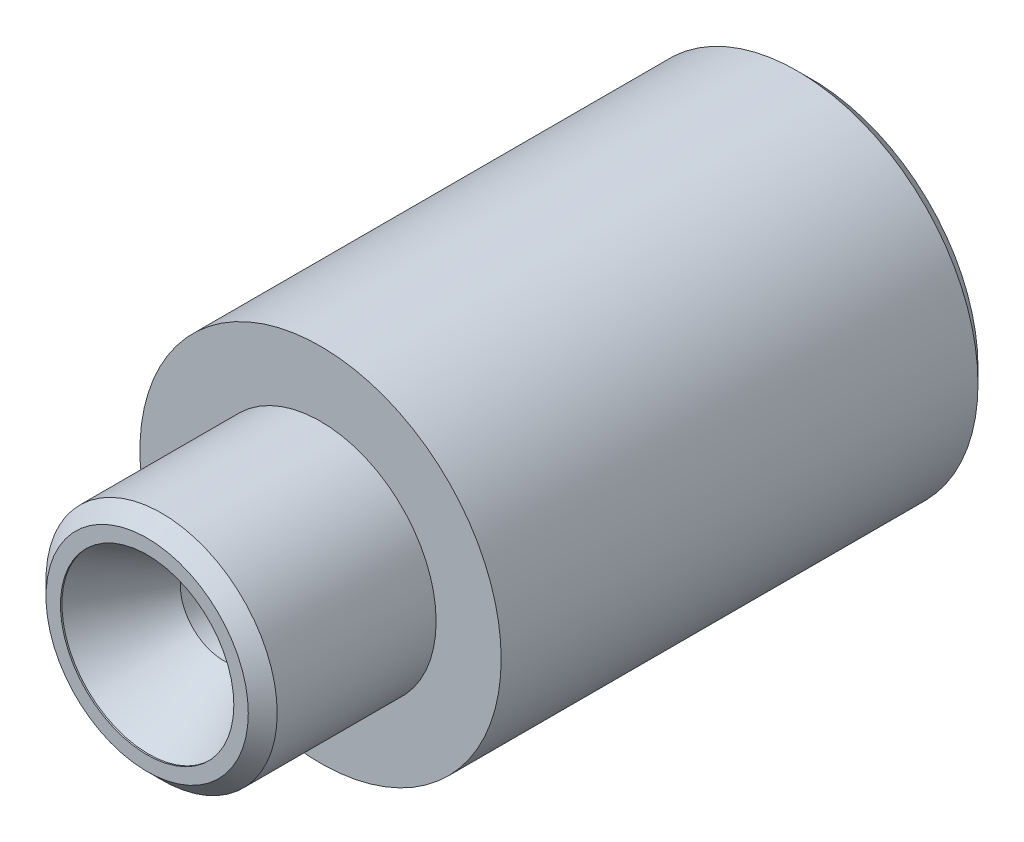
SolidWorks part; units mm, degrees
ref_plane "Plan1" through (0, 0, 0) normal (0, 0, 1) x (1, 0, 0)
ref_plane "Plan2" through (0, 0, 0) normal (0, 1, 0) x (1, 0, 0)
ref_plane "Plan3" through (0, 0, 0) normal (1, 0, 0) x (0, 0, -1)
sketch "Esquisse1" plane through (0, 0, 0) normal (0, 0, 1) x (1, 0, 0)
  circle A0 centre (0, 0) radius 6.25
  dimension "D1" = 12.5
extrude "cylindre" add sketch "Esquisse1" along normal blind 17
sketch "Esquisse2" plane through (0, 0, 17) normal (0, 0, 1) x (1, 0, 0)
  circle A0 centre (0, 0) radius 4
  circle A1 centre (0, 0) radius 6.25 construction
  dimension "D1" = 8
extrude "épaulement" add sketch "Esquisse2" along normal blind 6
chamfer "Chanfrein1" distance 0.5 angle 45
hole_wizard "Perçage" positions "Esquisse6" profile "Esquisse5" legacy
sketch "Esquisse6" plane through (0, 0, 0) normal (0, 0, -1) x (-1, 0, 0)
  point P0 (0, 0)
sketch "Esquisse5" plane through (0, 0, 0) normal (1, 0, 0) x (0, 1, 0)
  line L0 (0, 0) -> (0, 13.5515)
  line L1 (0, 13.5515) -> (1.75, 12.5)
  line L2 (1.75, 12.5) -> (1.75, 0)
  line L4 (1.75, 0) -> (0, 0)
  line L6 (0, 13.5515) -> (-1.75, 12.5) construction
  line L7 (0, -4.2442) -> (0, 117.3081) construction
  dimension "Diamètre" = 3.5
  dimension "Profondeur" = 12.5
  dimension "Angle" = 118
hole_wizard "contre-pointe" positions "Esquisse14" profile "Esquisse13" legacy
sketch "Esquisse14" plane through (0, 0, 23) normal (0, 0, 1) x (1, 0, 0)
  point P0 (0, 0)
sketch "Esquisse13" plane through (0, 0, 23) normal (1, 0, 0) x (0, -1, 0)
  line L0 (0, 0) -> (0, 5.366)
  line L1 (0, 5.366) -> (1.5, 4.5)
  line L2 (1.5, 4.5) -> (1.5, 2.6481)
  line L3 (1.5, 2.6481) -> (3, 0.05)
  line L4 (3, 0.05) -> (3, 0)
  line L5 (3, 0) -> (0, 0)
  line L6 (0, -6.13) -> (0, 109.2824) construction
  line L7 (-1.5, 2.6481) -> (-3, 0.05) construction
  line L8 (0, 5.366) -> (-1.5, 4.5) construction
  dimension "Diamètre" = 3
  dimension "Profondeur" = 4.5
  dimension "Diamètre contre-pointe" = 6
  dimension "Profondeur contre-pointe" = 0.05
  dimension "Angle" = 120
  dimension "Angle contre-pointe" = 60
